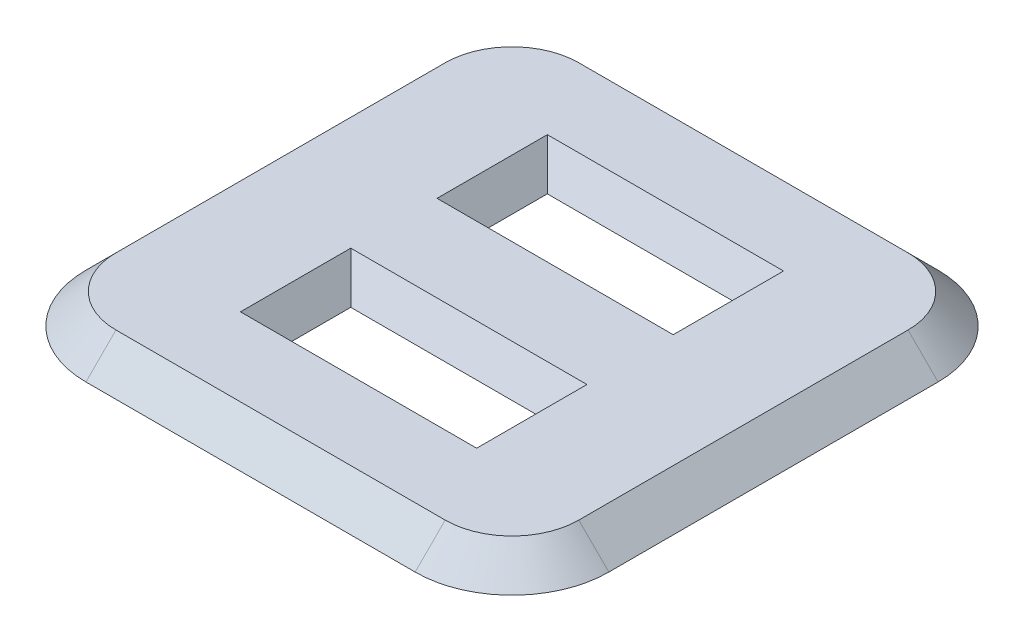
SolidWorks part; units mm, degrees
ref_plane "Front Plane" through (0, 0, 0) normal (0, 0, 1) x (1, 0, 0)
ref_plane "Top Plane" through (0, 0, 0) normal (0, 1, 0) x (1, 0, 0)
ref_plane "Right Plane" through (0, 0, 0) normal (1, 0, 0) x (0, 0, -1)
sketch "Sketch1" plane through (0, 0, 0) normal (0, 1, 0) x (1, 0, 0)
  line L1 (2.7, 2.7) -> (-2.7, 2.7)
  line L2 (2.7, 2.7) -> (2.7, -2.7)
  line L3 (2.7, -2.7) -> (-2.7, -2.7)
  line L4 (-2.7, 2.7) -> (-2.7, -2.7)
  line L5 (2.7, 2.7) -> (-2.7, -2.7) construction
  line L6 (2.7, -2.7) -> (-2.7, 2.7) construction
  point P0 (0, 0)
  dimension "D1" = 5.4
  dimension "D2" = 5.4
extrude "Boss-Extrude1" add sketch "Sketch1" along normal blind 0.31
fillet "Fillet1" radius 1 4 edges at (-2.7, 0.155, -2.7) (2.7, 0.155, -2.7) (2.7, 0.155, 2.7) (-2.7, 0.155, 2.7)
chamfer "Chamfer1" distance 0.31 angle 45 8 edges at (2.4071, 0.31, 2.4071) (0, 0.31, 2.7) (-2.4071, 0.31, 2.4071) (-2.7, 0.31, 0) (-2.4071, 0.31, -2.4071) (0, 0.31, -2.7) (2.4071, 0.31, -2.4071) (2.7, 0.31, 0)
sketch "Sketch2" plane through (0, 0.31, 0) normal (0, 1, 0) x (1, 0, 0)
  line L0 (2.7, -1.7) -> (2.7, 1.7) construction
  line L1 (1, 1.365) -> (-1, 1.365)
  line L2 (1, 1.365) -> (1, 0.665)
  line L3 (1, 0.665) -> (-1, 0.665)
  line L4 (-1, 1.365) -> (-1, 0.665)
  line L5 (1, 1.365) -> (-1, 0.665) construction
  line L6 (1, 0.665) -> (-1, 1.365) construction
  line L8 (-2.39, 0) -> (2.39, 0) construction
  line L9 (-2.39, 1.7) -> (-2.39, -1.7) construction
  line L10 (2.39, -1.7) -> (2.39, 1.7) construction
  line L11 (1, -0.665) -> (-1, -0.665)
  line L12 (-1, -1.365) -> (-1, -0.665)
  line L13 (1, -1.365) -> (-1, -1.365)
  line L14 (1, -1.365) -> (1, -0.665)
  point P0 (0, 0)
  dimension "D1" = 2
  dimension "D2" = 0.7
  dimension "D3" = 1.7
  dimension "D4" = 1.33
extrude "Cut-Extrude1" cut sketch "Sketch2" against normal through all
chamfer "Chamfer2" distance 0.31 angle 35.3 8 edges at (1, 0.31, -1.015) (0, 0.31, -0.665) (-1, 0.31, -1.015) (0, 0.31, -1.365) (-1, 0.31, 1.015) (0, 0.31, 1.365) (1, 0.31, 1.015) (0, 0.31, 0.665)
